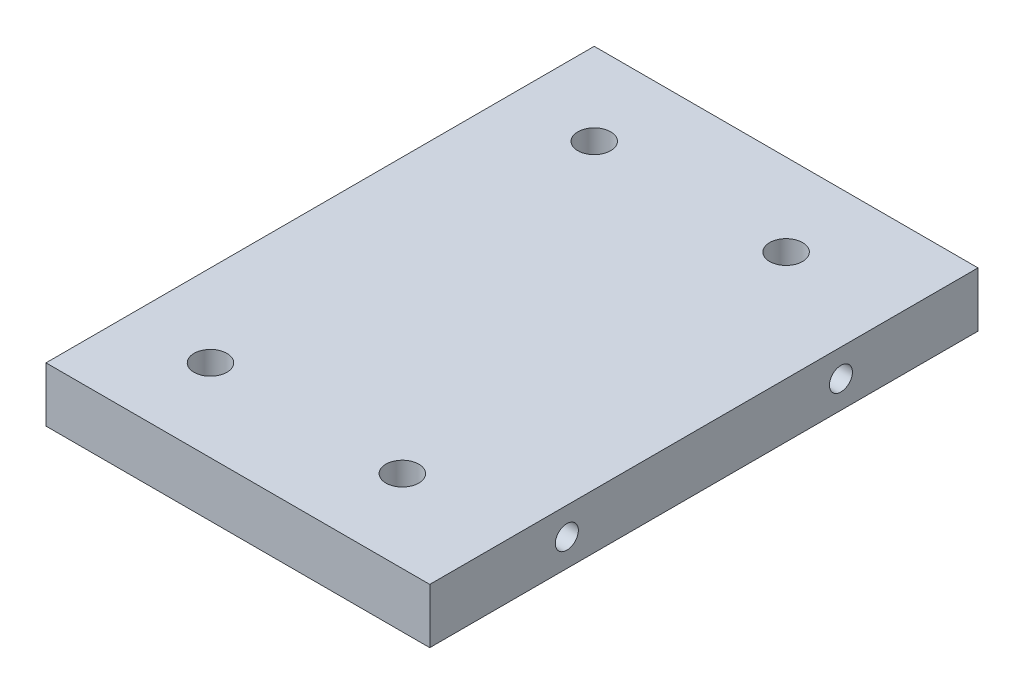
SolidWorks part; units mm, degrees
ref_plane "Plan de face" through (0, 0, 0) normal (0, 0, 1) x (1, 0, 0)
ref_plane "Plan de dessus" through (0, 0, 0) normal (0, 1, 0) x (1, 0, 0)
ref_plane "Plan de droite" through (0, 0, 0) normal (1, 0, 0) x (0, 0, -1)
sketch "Esquisse1" plane through (0, 0, 0) normal (0, 0, 1) x (1, 0, 0)
  line L1 (0, 0) -> (70, 0)
  line L2 (0, 0) -> (0, 10)
  line L3 (0, 10) -> (70, 10)
  line L4 (70, 0) -> (70, 10)
  dimension "D1" = 10
  dimension "D2" = 70
extrude "Boss.-Extru.1" add sketch "Esquisse1" along normal blind 100
sketch "Esquisse2" plane through (0, 10, 0) normal (0, 1, 0) x (1, 0, 0)
  line L0 (0, -100) -> (0, 0) construction
  line L2 (70, 0) -> (0, 0) construction
  circle A0 centre (15, -15) radius 3
  circle A1 centre (50, -15) radius 3
  circle A2 centre (50, -85) radius 3
  circle A3 centre (15, -85) radius 3
  dimension "D1" = 6
  dimension "D2" = 15
  dimension "D3" = 15
  dimension "D4" = 70
  dimension "D5" = 35
extrude "Enlèv. mat.-Extru.1" cut sketch "Esquisse2" against normal through all
hole_wizard "Trou taraudé M5x0.81" positions "Esquisse4" profile "Esquisse3" tap size "M5x0.8" standard "Ansi Metric"
sketch "Esquisse4" plane through (70, 0, 0) normal (1, 0, 0) x (0, 0, -1)
  line L0 (-100, 0) -> (0, 0) construction
  line L1 (-100, 0) -> (-100, 10) construction
  line L2 (0, 0) -> (0, 10) construction
  point P0 (-75, 5)
  point P2 (-25, 5)
  dimension "D1" = 5
  dimension "D2" = 25
  dimension "D3" = 25
sketch "Esquisse3" plane through (70, 5, 75) normal (0, 1, 0) x (0, 0, -1)
  line L0 (0, 0) -> (0, 16.2618)
  line L1 (0, 16.2618) -> (2.1, 15)
  line L2 (2.1, 15) -> (2.1, 0)
  line L5 (2.1, 0) -> (0, 0)
  line L10 (0, 16.2618) -> (-2.1, 15) construction
  line L11 (0, -6.35) -> (0, 107.95) construction
  dimension "Diamètre du trou pour taraudage" = 4.2
  dimension "Profondeur du trou pour taraudage" = 15
  dimension "Angle de pointe" = 118
